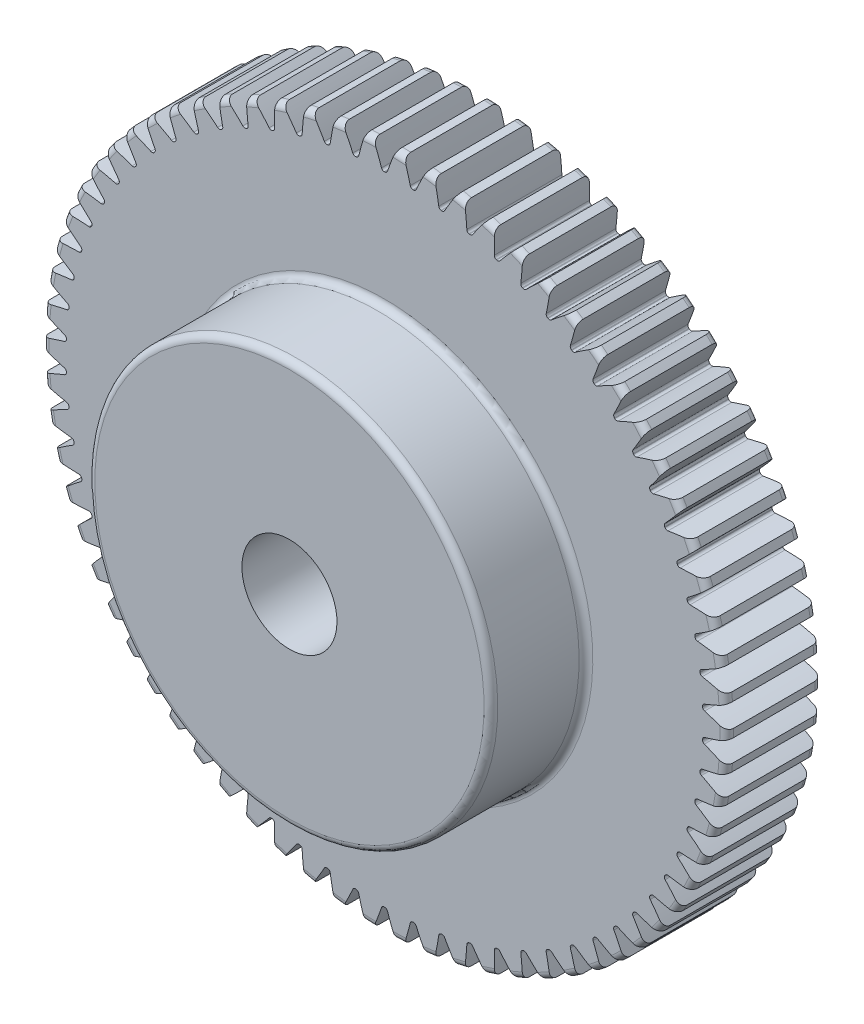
SolidWorks part; units mm, degrees
ref_plane "Front Plane" through (0, 0, 0) normal (0, 0, 1) x (1, 0, 0)
ref_plane "Top Plane" through (0, 0, 0) normal (0, 1, 0) x (1, 0, 0)
ref_plane "Right Plane" through (0, 0, 0) normal (1, 0, 0) x (0, 0, -1)
sketch "Sketch1" plane through (0, 0, 0) normal (0, 0, 1) x (1, 0, 0)
  line L0 (-889, 0) -> (889, 0) construction
  circle A0 centre (0, 0) radius 45.72 construction
  circle A1 centre (0, 0) radius 44.45 construction
  circle A2 centre (0, 0) radius 42.545 construction
  circle A3 centre (0, 0) radius 26.924 construction
  circle A4 centre (0, 0) radius 6.35 construction
sketch "Sketch2" plane through (0, 0, 0) normal (1, 0, 0) x (0, 0, -1)
  line L0 (0, 0) -> (-12.7, 0) construction
  line L1 (-12.7, 0) -> (-25.4, 0) construction
  dimension "Overall Width" = 25.4
  dimension "Face Width" = 12.7
sketch "Sketch4" plane through (0, 0, 0) normal (1, 0, 0) x (0, 0, -1)
  line L0 (-25.4, 6.35) -> (-25.4, 26.924)
  line L1 (-25.4, 26.924) -> (-12.7, 26.924)
  line L2 (-12.7, 26.924) -> (-12.7, 45.72)
  line L3 (-12.7, 45.72) -> (0, 45.72)
  line L4 (0, 45.72) -> (0, 6.35)
  line L5 (-12.7, 26.924) -> (-12.7, 0) construction
  line L6 (0, 45.72) -> (0, -45.72) construction
  line L7 (-12.7, 26.924) -> (0, 26.924) construction
  line L12 (-25.4, 6.35) -> (0, 6.35)
revolve "Revolve1" add sketch "Sketch4" angle 360 about L1
fillet "Fillet2" radius 0.9144 4 edges at (0, 26.924, 25.4) (0, 26.924, 12.7) (0, 45.72, 12.7) (0, 45.72, 0)
sketch "Sketch7" plane through (0, 0, 12.7) normal (0, 0, 1) x (1, 0, 0)
  line L0 (0, 0) -> (0, 45.72) construction
  line L1 (0.9974, 44.4388) -> (1.4871, 45.6958) construction
  line L3 (2.0512, 45.674) -> (1.9942, 44.4052) construction
  line L4 (1.9942, 44.4052) -> (1.9088, 42.5022) construction
  line L5 (0, 0) -> (1.9088, 42.5022) construction
  line L6 (0.9974, 44.4388) -> (0, 0) construction
  line L7 (0.9974, 44.4388) -> (1.0259, 45.7085) construction
  line L8 (0.9974, 44.4388) -> (0, 0) construction
  circle A0 centre (0, 0) radius 45.72 construction
  arc A1 (-0.0358, 42.545) -> (0.0358, 42.545) centre (0, 0) cw
  circle A2 centre (0, 0) radius 42.545 construction
  arc A3 (-0.9974, 44.4388) -> (0.9974, 44.4388) centre (0, 0) cw construction
  circle A4 centre (0, 0) radius 44.45 construction
  arc A5 (2.5931, 45.6464) -> (1.509, 45.6951) centre (0, 0) ccw construction
  arc A6 (0.9974, 44.4388) -> (2.9901, 44.3493) centre (0, 0) cw construction
  arc A7 (-1.509, 45.6951) -> (1.509, 45.6951) centre (0, 0) cw
  arc A8 (0.3963, 42.8017) -> (1.509, 45.6951) centre (42.4151, 28.3026) cw
  arc A9 (-0.3963, 42.8017) -> (-1.509, 45.6951) centre (-42.4151, 28.3026) ccw
  arc A10 (-0.0358, 42.545) -> (-0.3963, 42.8017) centre (-0.0361, 42.926) cw
  arc A11 (0.0358, 42.545) -> (0.3963, 42.8017) centre (0.0361, 42.926) ccw
  point P26 (-0.3082, 42.5439)
  point P29 (0.3082, 42.5439)
extrude "Cut-Extrude2" cut sketch "Sketch7" against normal through all
pattern_circular "CirPattern1" count 70 over 360 about axis through (0, 0, 0) along (0, 0, 1) of "Cut-Extrude2"
fillet "Fillet3" radius 1.016 1 edges at (0, 6.35, 0)
equation "\"D1@Sketch1\"=2.5*(\"Pitch Dia.@Sketch1\"/\"Number of Teeth@Sketch1\")"
equation "\"D1@CirPattern1\"=\"Number of Teeth@Sketch1\""
equation "\"D1@Fillet2\"=\"OD@Sketch1\"*.01"
equation "\"D1@Sketch7\"=3.14159*(\"Pitch Dia.@Sketch1\"/\"Number of Teeth@Sketch1\")"
equation "\"D2@Sketch7\"=\"D1@Sketch7\"/2"
equation "\"D4@Sketch7\"=\"D1@Sketch7\"*.0955"
equation "\"D5@Sketch7\"=\"Pitch Dia.@Sketch1\"/2"
